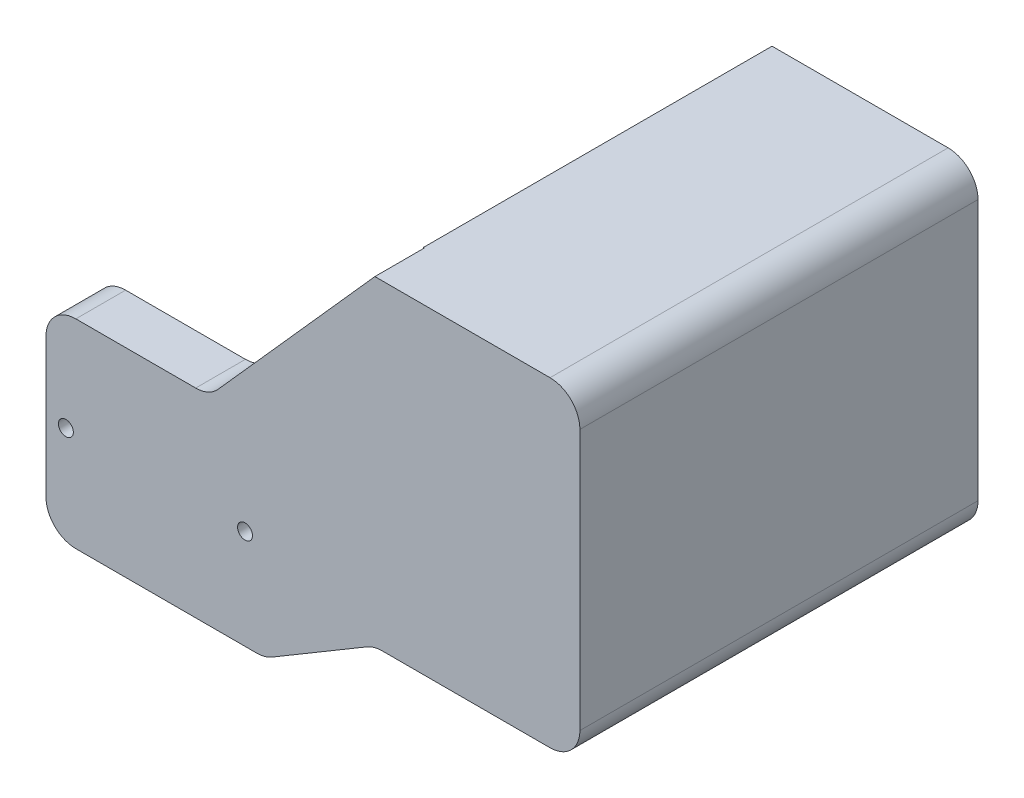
SolidWorks part; units mm, degrees
ref_plane "Alzado" through (0, 0, 0) normal (0, 0, 1) x (1, 0, 0)
ref_plane "Planta" through (0, 0, 0) normal (0, 1, 0) x (1, 0, 0)
ref_plane "Vista lateral" through (0, 0, 0) normal (1, 0, 0) x (0, 0, -1)
sketch "Croquis1" plane through (0, 0, 0) normal (0, 0, 1) x (1, 0, 0)
  line L0 (11, 0) -> (21.95, 0) construction
  line L1 (-11, 10) -> (11, 10)
  line L2 (-11, 10) -> (-11, -10)
  line L3 (-11, -10) -> (11, -10)
  line L4 (11, 10) -> (11, -10)
  line L5 (-11, 10) -> (11, -10) construction
  line L6 (-11, -10) -> (11, 10) construction
  line L7 (21.95, 0) -> (21.95, 1.4) construction
  line L8 (21.95, 0) -> (21.95, -3.5) construction
  line L9 (21.95, -3.5) -> (37.55, -3.5) construction
  line L10 (37.6454, 1.4) -> (37.6454, 23.7997) construction
  line L11 (21.95, -3.5) -> (11, -3.5) construction
  line L12 (21.95, 1.4) -> (37.6454, 1.4) construction
  line L13 (37.6454, 23.7997) -> (22.0454, 23.7997) construction
  line L14 (22.0454, 23.7997) -> (22.0454, 28.7041) construction
  line L15 (37.6454, 12.5999) -> (42.6454, 12.5999) construction
  line L16 (42.6454, 12.5999) -> (42.6454, 28.7041) construction
  line L17 (42.6454, 28.7041) -> (22.0454, 28.7041) construction
  line L18 (42.6454, 12.5999) -> (42.6454, -3.5) construction
  line L19 (42.6454, -3.5) -> (37.55, -3.5) construction
  line L20 (37.6454, 1.4) -> (37.6454, 23.7997)
  line L21 (37.6454, 23.7997) -> (22.0454, 23.7997)
  line L22 (22.0454, 23.7997) -> (22.0454, 28.7041)
  line L23 (22.0454, 28.7041) -> (42.6454, 28.7041)
  line L24 (42.6454, 28.7041) -> (42.6454, -3.5)
  line L25 (42.6454, -3.5) -> (21.95, -3.5)
  line L26 (21.95, -3.5) -> (21.95, 1.4)
  line L27 (21.95, 1.4) -> (37.6454, 1.4)
  point P0 (0, 0)
  dimension "D1" = 20
  dimension "D2" = 22
  dimension "D3" = 10.95
  dimension "D4" = 1.4
  dimension "D6" = 3.5
extrude "Saliente-Extruir1" add sketch "Croquis1" against normal blind 30
sketch "Croquis2" plane through (0, 28.7041, 0) normal (0, 1, 0) x (1, 0, 0)
  line L0 (42.6454, 30) -> (42.6454, 20.0934) construction
sketch "Croquis3" plane through (0, 0, -30) normal (0, 0, -1) x (-1, 0, 0)
  line L1 (-42.6454, 28.7041) -> (-21.95, 28.7041)
  line L2 (-42.6454, 28.7041) -> (-42.6454, -3.5)
  line L3 (-42.6454, -3.5) -> (-21.95, -3.5)
  line L4 (-21.95, 28.7041) -> (-21.95, -3.5)
extrude "Saliente-Extruir2" add sketch "Croquis3" along normal blind 5
sketch "Croquis4" plane through (0, 0, -30) normal (0, 0, -1) x (-1, 0, 0)
  line L1 (-11, 10) -> (11, 10)
  line L2 (-11, 10) -> (-11, -10)
  line L3 (-11, -10) -> (11, -10)
  line L4 (11, 10) -> (11, -10)
extrude "Cortar-Extruir1" cut sketch "Croquis4" against normal blind 20
sketch "Croquis5" plane through (0, 0, 0) normal (0, 0, 1) x (1, 0, 0)
  line L1 (-11, 10) -> (11, 10)
  line L2 (-11, 10) -> (-11, -10)
  line L3 (-11, -10) -> (11, -10)
  line L4 (11, 10) -> (11, -10)
  line L5 (-11, 10) -> (11, -10) construction
  line L6 (-11, -10) -> (11, 10) construction
  point P0 (0, 0)
extrude "Saliente-Extruir3" add sketch "Croquis5" along normal blind 10
sketch "Croquis6" plane through (0, 0, -10) normal (0, 0, -1) x (-1, 0, 0)
  line L1 (-11, 10) -> (11, 10)
  line L2 (-11, 10) -> (-11, -10)
  line L3 (-11, -10) -> (11, -10)
  line L4 (11, 10) -> (11, -10)
  line L5 (-11, 10) -> (11, -10) construction
  line L6 (-11, -10) -> (11, 10) construction
  point P0 (0, 0)
extrude "Cortar-Extruir2" cut sketch "Croquis6" against normal blind 10
sketch "Croquis7" plane through (0, 0, 10) normal (0, 0, 1) x (1, 0, 0)
  line L0 (-11, -10) -> (11, -10) construction
  line L1 (-11, 10) -> (11, 10)
  line L2 (-11, 10) -> (-11, -10)
  line L3 (-11, -10) -> (11, -10)
  line L4 (11, 10) -> (11, -10)
  line L5 (-11, 10) -> (11, -10) construction
  line L6 (-11, -10) -> (11, 10) construction
  point P0 (0, 0)
extrude "Cortar-Extruir3" cut sketch "Croquis7" against normal blind 5
sketch "Croquis8" plane through (0, 0, 5) normal (0, 0, 1) x (1, 0, 0)
  line L0 (11, -10) -> (11, -5.1)
  line L1 (11, -10) -> (11, 10) construction
  line L4 (21.95, -3.5) -> (11, -10)
  line L5 (21.95, -3.5) -> (42.6454, -3.5)
  line L6 (42.6454, -3.5) -> (42.6454, 28.7041) construction
  line L7 (21.95, -3.5) -> (42.6454, -3.5) construction
  line L8 (42.6454, -3.5) -> (42.6454, 28.7041)
  line L9 (42.6454, 28.7041) -> (22.0454, 28.7041)
  line L10 (22.0454, 28.7041) -> (5.3854, 10)
  line L11 (11, 10) -> (-11, 10) construction
  line L12 (5.3854, 10) -> (11, 10)
  line L13 (11, 10) -> (11, -5.1)
extrude "Saliente-Extruir6" add sketch "Croquis8" against normal blind 5
fillet "Redondeo2" radius 3 1 edges at (-11, 10, 2.5)
fillet "Redondeo3" radius 3 1 edges at (-11, -10, 2.5)
sketch "Croquis12" plane through (0, 0, 5) normal (0, 0, 1) x (1, 0, 0)
  line L0 (1.5, -10) -> (1.5, 10) construction
  line L1 (1.5, 10) -> (1.5, 7.997) construction
  line L2 (-8, -10) -> (11, -10) construction
  line L3 (5.3854, 10) -> (-8, 10) construction
  circle A0 centre (1.5, -8) radius 0.75
  circle A1 centre (1.5, 7.997) radius 0.75
  dimension "D1" = 1.5
  dimension "D2" = 1.5
extrude "Cortar-Extruir4" cut sketch "Croquis12" against normal blind 7
fillet "Redondeo4" radius 3 1 edges at (11, -10, 2.5)
fillet "Redondeo5" radius 3 1 edges at (42.6454, -3.5, -15)
fillet "Redondeo6" radius 3 1 edges at (42.6454, 28.7041, -15)
fillet "Redondeo7" radius 3 1 edges at (21.95, -3.5, 2.5)
fillet "Redondeo8" radius 3 1 edges at (5.3854, 10, 2.5)
sketch "Croquis13" plane through (0, 0, 5) normal (0, 0, 1) x (1, 0, 0)
  circle A0 centre (1.5, 7.997) radius 0.75
  circle A1 centre (1.5, -8) radius 0.75
extrude "Saliente-Extruir7" add sketch "Croquis13" against normal blind 5
sketch "Croquis14" plane through (0, 0, 5) normal (0, 0, 1) x (1, 0, 0)
  line L0 (-11, 0) -> (-9.0029, 0) construction
  line L1 (-11, 7) -> (-11, -7) construction
  line L2 (-9.0029, 0) -> (8.9971, 0) construction
  circle A0 centre (-9.0029, 0) radius 0.75
  circle A1 centre (8.9971, 0) radius 0.75
  dimension "D1" = 1.5
  dimension "D2" = 1.5
extrude "Cortar-Extruir5" cut sketch "Croquis14" against normal blind 6 and the other way blind 10
sketch "Croquis15" plane through (0, 0, -30) normal (0, 0, 1) x (1, 0, 0)
  line L1 (37.6454, 23.7997) -> (21.95, 23.7997)
  line L2 (37.6454, 23.7997) -> (37.6454, 1.4)
  line L3 (37.6454, 1.4) -> (21.95, 1.4)
  line L4 (21.95, 23.7997) -> (21.95, 1.4)
extrude "Saliente-Extruir8" add sketch "Croquis15" along normal blind 1.02
sketch "Croquis16" plane through (0, 0, -30) normal (0, 0, 1) x (1, 0, 0)
  line L1 (21.95, 28.7041) -> (22.0454, 28.7041)
  line L2 (21.95, 28.7041) -> (21.95, 23.7997)
  line L3 (21.95, 23.7997) -> (22.0454, 23.7997)
  line L4 (22.0454, 28.7041) -> (22.0454, 23.7997)
extrude "Saliente-Extruir9" add sketch "Croquis16" along normal blind 30.02
